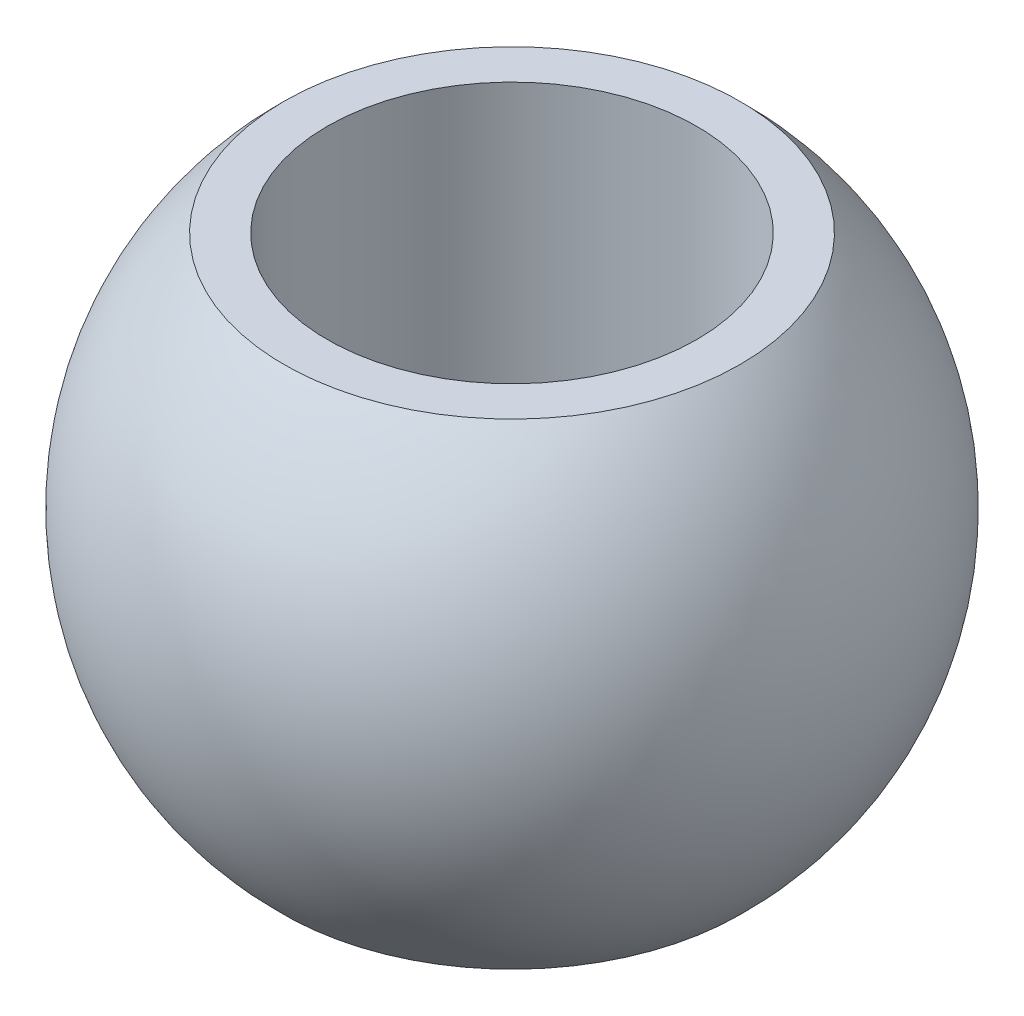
SolidWorks part; units mm, degrees
ref_plane "Plan1" through (0, 0, 0) normal (0, 0, 1) x (1, 0, 0)
ref_plane "Plan2" through (0, 0, 0) normal (0, 1, 0) x (1, 0, 0)
ref_plane "Plan3" through (0, 0, 0) normal (1, 0, 0) x (0, 0, -1)
sketch "Esquisse1" plane through (0, 0, 0) normal (0, 0, 1) x (1, 0, 0)
  line L0 (11.6, 0) -> (-11.6, 0)
  line L1 (20, 0) -> (-20, 0) construction
  arc A0 (11.6, 0) -> (-11.6, 0) centre (0, 0) ccw
  dimension "D1" = 23.2
revolve "Base-Révolution" add sketch "Esquisse1" angle 360 about L1
sketch "Esquisse2" plane through (0, 0, 0) normal (0, 0, 1) x (1, 0, 0)
  line L0 (-20, 0) -> (20, 0) construction
  line L2 (20, 0) -> (-20, 0) construction
  line L3 (12.9088, 8.38) -> (-13.0729, 8.38)
  line L4 (12.9088, -8.38) -> (-13.0729, -8.38)
  line L5 (12.9088, 8.38) -> (12.9088, -8.38)
  line L6 (-13.0729, 8.38) -> (-13.0729, -8.38)
  dimension "D1" = 8.38
extrude "Enlèv. mat.-Extru.1" cut sketch "Esquisse2" against normal mid plane 30 flip side to cut
sketch "Esquisse3" plane through (0, 8.38, 0) normal (0, 1, 0) x (-1, 0, 0)
  circle A0 centre (0, 0) radius 6.5
  dimension "D1" = 13
extrude "Enlèv. mat.-Extru.2" cut sketch "Esquisse3" against normal through all
